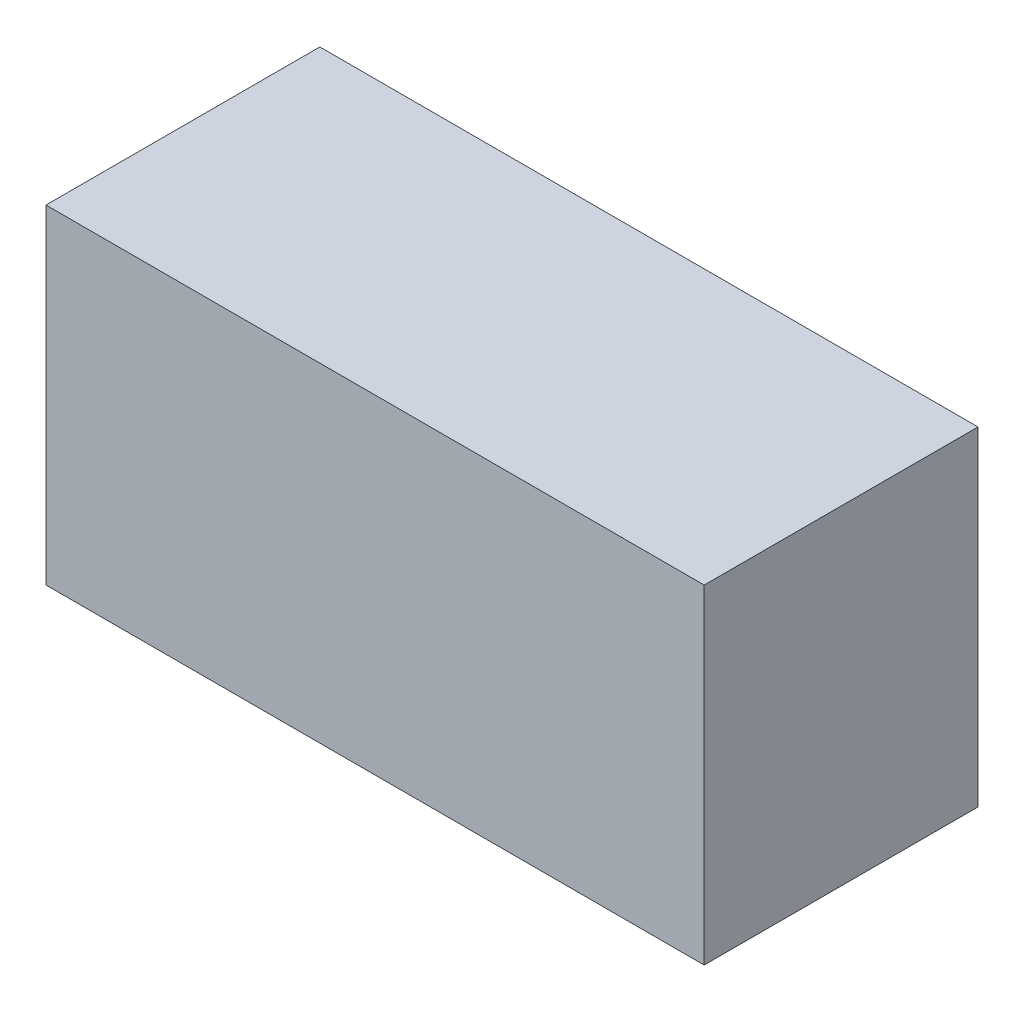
SolidWorks part; units mm, degrees
ref_plane "Front Plane" through (0, 0, 0) normal (0, 0, 1) x (1, 0, 0)
ref_plane "Top Plane" through (0, 0, 0) normal (0, 1, 0) x (1, 0, 0)
ref_plane "Right Plane" through (0, 0, 0) normal (1, 0, 0) x (0, 0, -1)
sketch "Sketch1" plane through (0, 0, 0) normal (0, 0, 1) x (1, 0, 0)
  line L1 (-127, 63.5) -> (127, 63.5)
  line L2 (-127, 63.5) -> (-127, -63.5)
  line L3 (-127, -63.5) -> (127, -63.5)
  line L4 (127, 63.5) -> (127, -63.5)
  line L5 (-127, 63.5) -> (127, -63.5) construction
  line L6 (-127, -63.5) -> (127, 63.5) construction
  point P0 (0, 0)
  dimension "D1" = 254
  dimension "D2" = 127
extrude "Boss-Extrude1" add sketch "Sketch1" along normal blind 105.664
equation "\"test\"=\"RD1@Annotations\""
equation "\"D1@Sketch1\"=IIf(\"D2@Sketch1\"<6,10,\"test\")"
